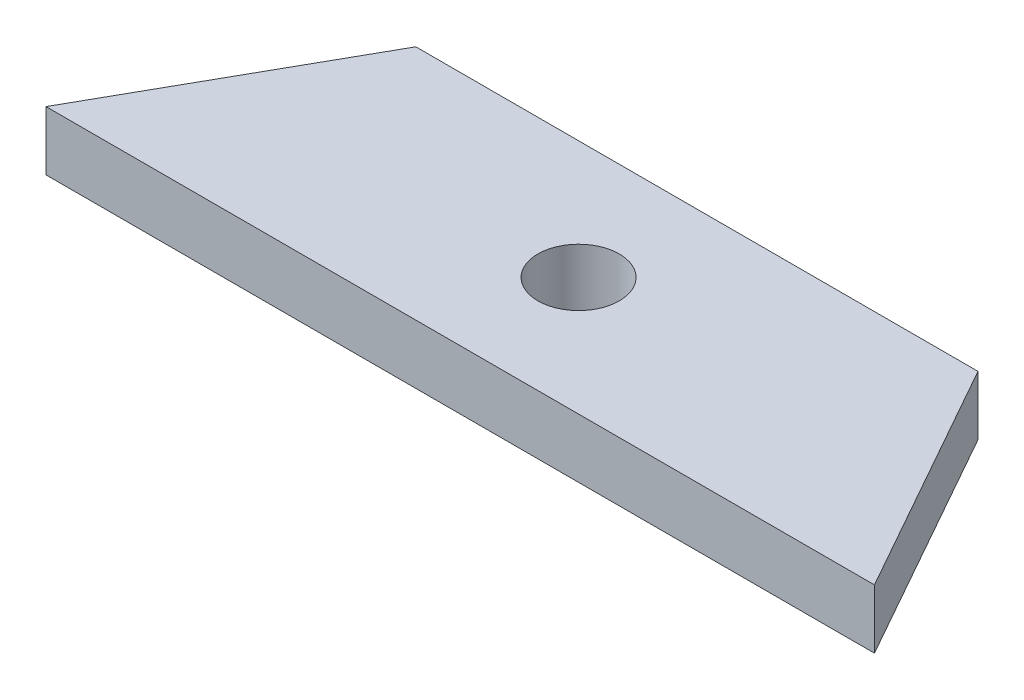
SolidWorks part; units mm, degrees
ref_plane "Front Plane" through (0, 0, 0) normal (0, 0, 1) x (1, 0, 0)
ref_plane "Top Plane" through (0, 0, 0) normal (0, 1, 0) x (1, 0, 0)
ref_plane "Right Plane" through (0, 0, 0) normal (1, 0, 0) x (0, 0, -1)
sketch "Sketch1" plane through (0, 0, 0) normal (0, 1, 0) x (1, 0, 0)
  line L0 (0, 0) -> (56, 0)
  line L1 (56, 0) -> (47, 16)
  line L2 (47, 16) -> (9, 16)
  line L3 (9, 16) -> (0, 0)
  line L4 (28, 16) -> (28, 0) construction
  circle A0 centre (28, 8) radius 2.75
  dimension "D1" = 28
  dimension "D2" = 16
  dimension "D3" = 38
  dimension "D4" = 5.5
extrude "Extrude1" add sketch "Sketch1" along normal blind 4
